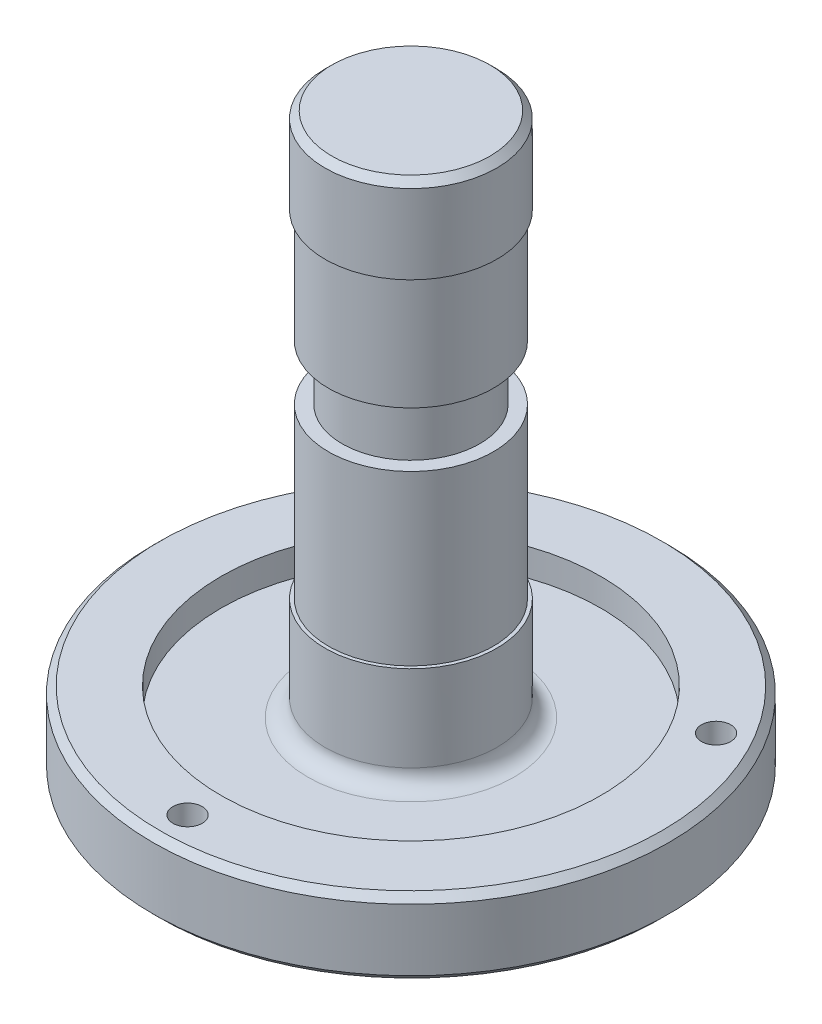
SolidWorks part; units mm, degrees
ref_plane "Plan de face" through (0, 0, 0) normal (0, 0, 1) x (1, 0, 0)
ref_plane "Plan de dessus" through (0, 0, 0) normal (0, 1, 0) x (1, 0, 0)
ref_plane "Plan de droite" through (0, 0, 0) normal (1, 0, 0) x (0, 0, -1)
sketch "Esquisse1" plane through (0, 0, 0) normal (0, 0, 1) x (1, 0, 0)
  line L0 (34.9, 0) -> (34.9, 8)
  line L1 (0, 175) -> (25, 175)
  line L2 (0, 175) -> (0, 0)
  line L3 (0, 0) -> (34.9, 0)
  line L4 (25, 175) -> (25, 150)
  line L5 (24, 52) -> (25, 52)
  line L6 (55.25, 30) -> (75, 30)
  line L7 (34.9, 8) -> (75, 8)
  line L8 (75, 30) -> (75, 8)
  line L9 (24, 52) -> (24, 101)
  line L10 (55.25, 30) -> (55.25, 22)
  line L11 (55.25, 22) -> (25, 22)
  line L12 (25, 52) -> (25, 22)
  line L13 (24, 117) -> (24, 150)
  line L14 (24, 101) -> (20, 101)
  line L15 (24, 150) -> (25, 150)
  line L16 (24, 117) -> (20, 117)
  line L17 (20, 101) -> (20, 117)
  line L18 (0, 209.6049) -> (0, -46.8142) construction
  dimension "D1" = 8
  dimension "D2" = 8
  dimension "D3" = 22
  dimension "D4" = 30
  dimension "D5" = 55.25
  dimension "D6" = 34.9
  dimension "D7" = 75
  dimension "D8" = 25
  dimension "D9" = 175
  dimension "D10" = 25
  dimension "D11" = 1
  dimension "D12" = 16
  dimension "D13" = 20
  dimension "D14" = 25
  dimension "D15" = 71
revolve "Révolution1" add sketch "Esquisse1" angle 360 about L18
chamfer "Chanfrein1" distance 2 angle 45 4 edges at (-34.9, 0, 0) (-75, 8, 0) (-75, 30, 0) (-25, 175, 0)
fillet "Congé1" radius 5 1 edges at (-25, 22, 0)
hole_wizard "Trou taraudé M101" positions "Esquisse3" profile "Esquisse2" tap size "M10" standard "Iso"
sketch "Esquisse3" plane through (0, 8, 0) normal (0, -1, 0) x (-1, 0, 0)
  point P0 (0, -65)
  dimension "D1" = 65
sketch "Esquisse2" plane through (0, 8, 65) normal (1, 0, 0) x (0, 0, -1)
  line L0 (0, 0) -> (0, 30.0537)
  line L1 (0, 30.0537) -> (4.25, 27.5)
  line L2 (4.25, 27.5) -> (4.25, 0)
  line L5 (4.25, 0) -> (0, 0)
  line L10 (0, 30.0537) -> (-4.25, 27.5) construction
  line L11 (0, -6.35) -> (0, 107.95) construction
  dimension "Diamètre du trou pour taraudage" = 8.5
  dimension "Profondeur du trou pour taraudage" = 27.5
  dimension "Angle de pointe" = 118
pattern_circular "Répétition circulaire1" count 3 over 360 about axis through (0, 0, 0) along (0, 1, 0) of "Trou taraudé M101"
